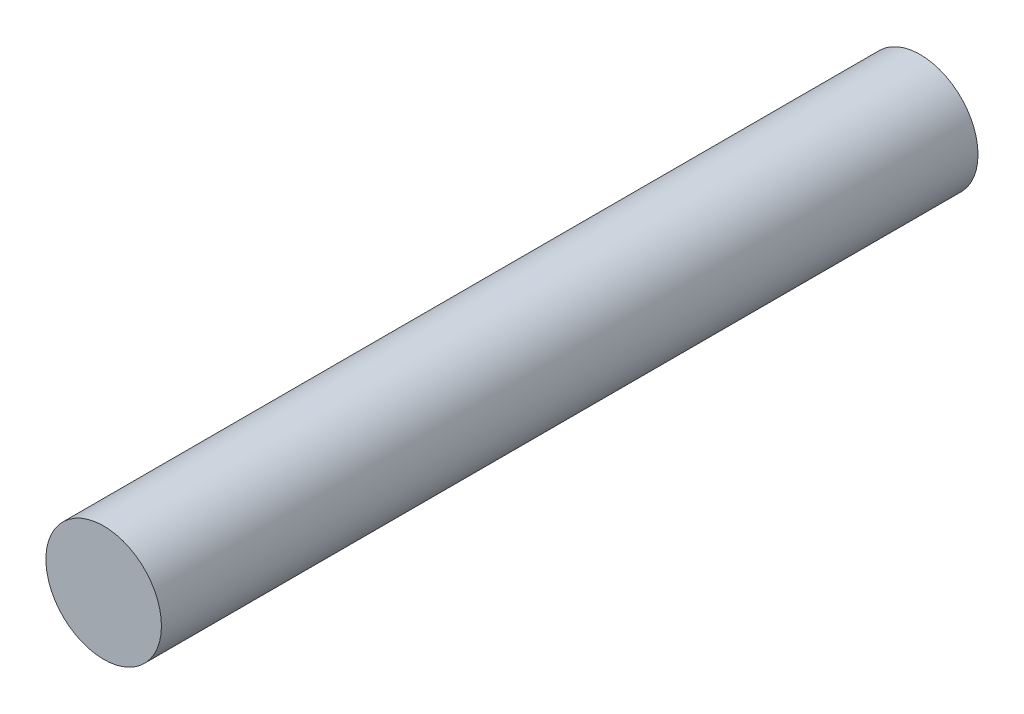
SolidWorks part; units mm, degrees
ref_plane "Front" through (0, 0, 0) normal (0, 0, 1) x (1, 0, 0)
ref_plane "Top" through (0, 0, 0) normal (0, 1, 0) x (1, 0, 0)
ref_plane "Right" through (0, 0, 0) normal (1, 0, 0) x (0, 0, -1)
sketch "Sketch1" plane through (0, 0, 0) normal (0, 0, 1) x (1, 0, 0)
  circle A1 centre (16.5237, -216.7794) radius 7.5
extrude "Extrude1" add sketch "Sketch1" along normal mid plane 106
